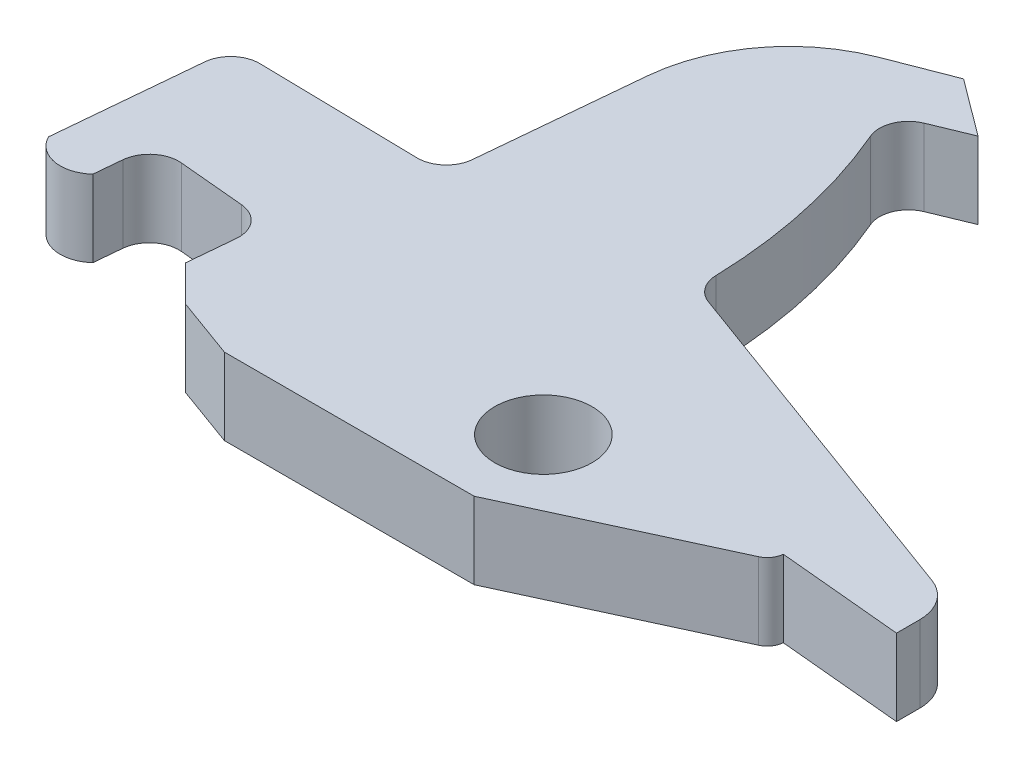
SolidWorks part; units mm, degrees
ref_plane "front" through (0, 0, 0) normal (0, 0, 1) x (1, 0, 0)
ref_plane "top" through (0, 0, 0) normal (0, 1, 0) x (1, 0, 0)
ref_plane "side" through (0, 0, 0) normal (1, 0, 0) x (0, 0, -1)
sketch "Sketch2" plane through (0, 0, 0) normal (0, 1, 0) x (1, 0, 0)
  line L0 (0.9176, 9.8114) -> (0.3846, 4.0276)
  line L1 (11.4951, 0.0347) -> (21.6085, 0.0368)
  line L2 (19.531, 11.6026) -> (33.8326, 6.3553)
  line L3 (29.9063, 4.2631) -> (34.964, 3.7879)
  line L4 (29.4902, 3.6752) -> (21.6085, 0.0368)
  line L5 (1.7668, 6.0037) -> (6.4564, 5.5715) construction
  line L6 (8.5793, 10.7473) -> (2.1037, 10.8723)
  line L7 (10.375, 18.2977) -> (9.7651, 11.8062)
  line L8 (17.6335, 22.2347) -> (19.1804, 22.8727)
  line L9 (19.1804, 22.8727) -> (16.8829, 24.5867)
  line L10 (14.4009, 23.624) -> (16.8829, 24.5867)
  line L11 (3.1434, 9.6062) -> (2.6104, 3.8225) construction
  line L12 (8.202, 9.14) -> (7.6689, 3.3563) construction
  line L13 (34.964, 4.735) -> (34.964, 3.7879)
  line L14 (34.964, 3.7879) -> (34.2402, -3.9171) construction
  line L15 (2.6933, 4.7226) -> (2.5912, 3.6142)
  line L16 (9.027, 0.9325) -> (11.4951, 0.0347)
  line L17 (9.027, 0.9325) -> (7.579, 2.3799)
  line L18 (7.7519, 4.2564) -> (7.579, 2.3799)
  line L19 (1.5127, 3.2468) -> (6.2023, 2.8146) construction
  line L20 (3.9882, 5.799) -> (6.6756, 5.5513)
  arc A0 (34.964, 4.735) -> (33.8326, 6.3553) centre (33.2381, 4.735) ccw
  arc A1 (18.7655, 12.668) -> (17.0051, 20.6943) centre (-3.0959, 12.0794) ccw
  arc A2 (29.9063, 4.2631) -> (29.4902, 3.6752) centre (29.1876, 4.3306) cw
  arc A3 (2.1037, 10.8723) -> (0.9176, 9.8114) centre (2.0811, 9.7041) ccw
  arc A4 (6.6756, 5.5513) -> (7.7519, 4.2564) centre (6.5663, 4.3657) cw
  arc A5 (18.7655, 12.668) -> (19.531, 11.6026) centre (19.9335, 12.6995) ccw
  arc A6 (17.6335, 22.2347) -> (17.0051, 20.6943) centre (18.0791, 21.1545) ccw
  arc A7 (2.6933, 4.7226) -> (3.9882, 5.799) centre (3.8789, 4.6134) cw
  arc A9 (10.375, 18.2977) -> (14.4009, 23.624) centre (16.6971, 17.7037) cw
  arc A10 (8.5793, 10.7473) -> (9.7651, 11.8062) centre (8.6018, 11.9155) ccw
  circle A11 centre (20.8524, 3.5974) radius 1.9717
  arc A12 (2.5912, 3.6142) -> (0.3846, 4.0276) centre (1.6408, 4.6372) cw
  point P33 (1.6405, 1.6196)
  point P34 (1.6959, 3.2246)
  point P36 (1.2229, 3.3049)
  point P37 (0.6117, 3.6935)
  point P39 (2.212, 3.3631)
  dimension "D1" = 11.43
  dimension "D2" = 2.2352
  dimension "D3" = 5.08
  dimension "D4" = 8.89
  dimension "D7" = 0.7219
  dimension "D6" = 1.1906
  dimension "D5" = 2.7686
  dimension "D8" = 20
  dimension "D9" = 45
extrude "Boss-Extrude1" add sketch "Sketch2" against normal blind 3.1058
